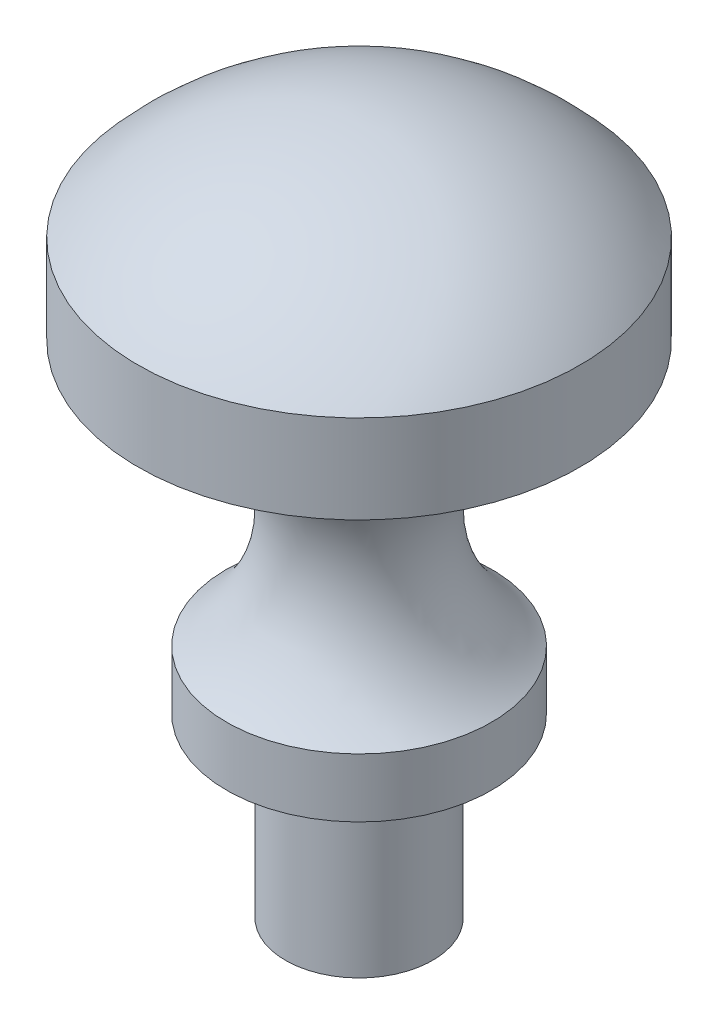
SolidWorks part; units mm, degrees
ref_plane "前视基准面" through (0, 0, 0) normal (0, 0, 1) x (1, 0, 0)
ref_plane "上视基准面" through (0, 0, 0) normal (0, 1, 0) x (1, 0, 0)
ref_plane "右视基准面" through (0, 0, 0) normal (1, 0, 0) x (0, 0, -1)
sketch "草图1" plane through (0, 0, 0) normal (0, 0, 1) x (1, 0, 0)
  line L0 (0, 157.4097) -> (0, 117.8168) construction
  line L1 (0, 130) -> (-2.5, 130)
  line L2 (-2.5, 130) -> (-2.5, 136)
  line L3 (-2.5, 136) -> (-4.5, 136)
  line L4 (-25, 136) -> (25, 136) construction
  line L5 (-4.5, 136) -> (-4.5, 138)
  line L6 (-7.5, 147) -> (-7.5, 150)
  line L7 (-25, 132) -> (25, 132) construction
  line L8 (0, 153.3856) -> (0, 130)
  arc A0 (-4.5, 138) -> (-7.5, 147) centre (-7.5, 142) ccw
  arc A1 (-7.5, 150) -> (0, 153.3856) centre (0, 143.3856) cw
  dimension "D3" = 7.5
  dimension "D7" = 5
  dimension "D8" = 10
  dimension "D1" = 2
  dimension "D2" = 9
  dimension "D4" = 6
  dimension "D5" = 3
  dimension "D6" = 11
revolve "旋转1" add sketch "草图1" angle 360 about L0
